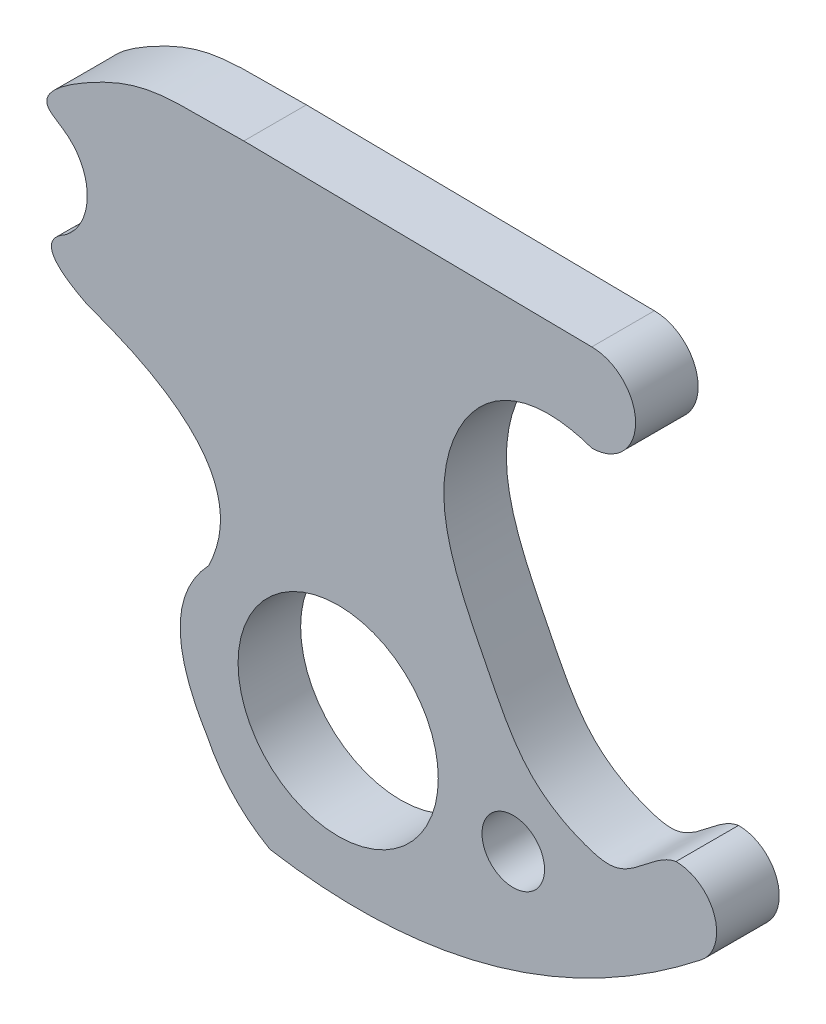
SolidWorks part; units mm, degrees
ref_plane "Plan de face" through (0, 0, 0) normal (0, 0, 1) x (1, 0, 0)
ref_plane "Plan de dessus" through (0, 0, 0) normal (0, 1, 0) x (1, 0, 0)
ref_plane "Plan de droite" through (0, 0, 0) normal (1, 0, 0) x (0, 0, -1)
sketch "Esquisse1" plane through (0, 0, 0) normal (0, 0, 1) x (1, 0, 0)
  line L0 (0, 0) -> (35.6689, 0) construction
  circle A0 centre (0, 0) radius 8
  arc A1 (28.9868, -2.0684) -> (26.9954, 3.75) centre (26.9954, 0.5) ccw
  arc A3 (20.2656, 29) -> (20.2656, 36) centre (20.2656, 32.5) ccw
  arc A5 (-10.4719, -6.2961) -> (-5.4407, -11.6368) centre (0.5, -1) ccw
  spline S0 degree 2 poles (-20.0526, 18.7686) (-6.2319, 13.9479) (-10.3537, 5.5527) knots 0 0 0 1 1 1
  spline S1 degree 3 poles (26.9954, 3.75) (25.2656, 3.447) (23.2438, 0.2589) (18.8507, 1.4608) (14.7678, 3.8176) (11.3343, 10.8582) (5.6527, 21.5871) (12.8124, 31.608) (20.2656, 29) knots 0 0 0 0 0.121513 0.169899 0.270902 0.41383 0.654508 1 1 1 1
  spline S2 degree 2 poles (-5.4407, -11.6368) (12.9559, -14.7022) (28.9868, -2.0684) knots 0 0 0 1 1 1
  spline S3 degree 2 poles (-10.4719, -6.2961) (-14.8368, 0.7983) (-10.3537, 5.5527) knots 0 0 0 1 1 1
  spline S4 degree 2 poles (-21.753, 22.7595) (-24.7414, 21.1377) (-20.0526, 18.7686) knots 0 0 0 1 1 1
  spline S5 degree 3 poles (-21.753, 22.7595) (-19.5134, 24.5036) (-19.4406, 28.828) (-24.5834, 31.2786) (-15.9309, 37.0657) (-13.2527, 36.2027) (-7.5388, 36.3506) knots 0 0 0 0 0.289181 0.355399 0.522693 1 1 1 1
  spline S6 degree 1 poles (20.2656, 36) (-7.5388, 36.3506) knots 0 0 1 1
  dimension "D1" = 0.5
  dimension "D4" = 6.5
  dimension "D5" = 7
  dimension "D9" = 25.25
  dimension "D10" = 16
  dimension "D2" = 1
  dimension "D3" = 27
  dimension "D6" = 32
  dimension "D7" = 32.7
  dimension "D8" = 32.5
  dimension "D11" = 35.3793
  dimension "D12" = 32.9891
  dimension "D13" = 40.3182
extrude "Extrusion1" add sketch "Esquisse1" along normal blind 5
hole_wizard "Dégagement M51" positions "Esquisse3D5" profile "Esquisse6" hole size "M5" standard "ISO"
sketch3d "Esquisse3D5"
  arc A1 (28.9868, -2.0684, 5) -> (26.9954, 3.75, 5) centre (26.9954, 0.5, 5) ccw construction
  point P0 (13.9913, -2.0597, 5)
  point P12 (26.9954, 0.5, 8.25)
  dimension "D1" = 15
  dimension "D2" = 13.2536
sketch "Esquisse6" plane through (13.9913, -2.0597, 5) normal (1, 0, 0) x (0, -1, 0)
  line L0 (0, 0) -> (0, 11.5022)
  line L1 (0, 11.5022) -> (2.5, 10)
  line L2 (2.5, 10) -> (2.5, 0)
  line L5 (2.5, 0) -> (0, 0)
  line L10 (0, 11.5022) -> (-2.5, 10) construction
  line L11 (0, -6.35) -> (0, 107.95) construction
  dimension "Diamètre du perçage" = 5
  dimension "Profondeur du perçage" = 10
  dimension "Angle de pointe" = 118
